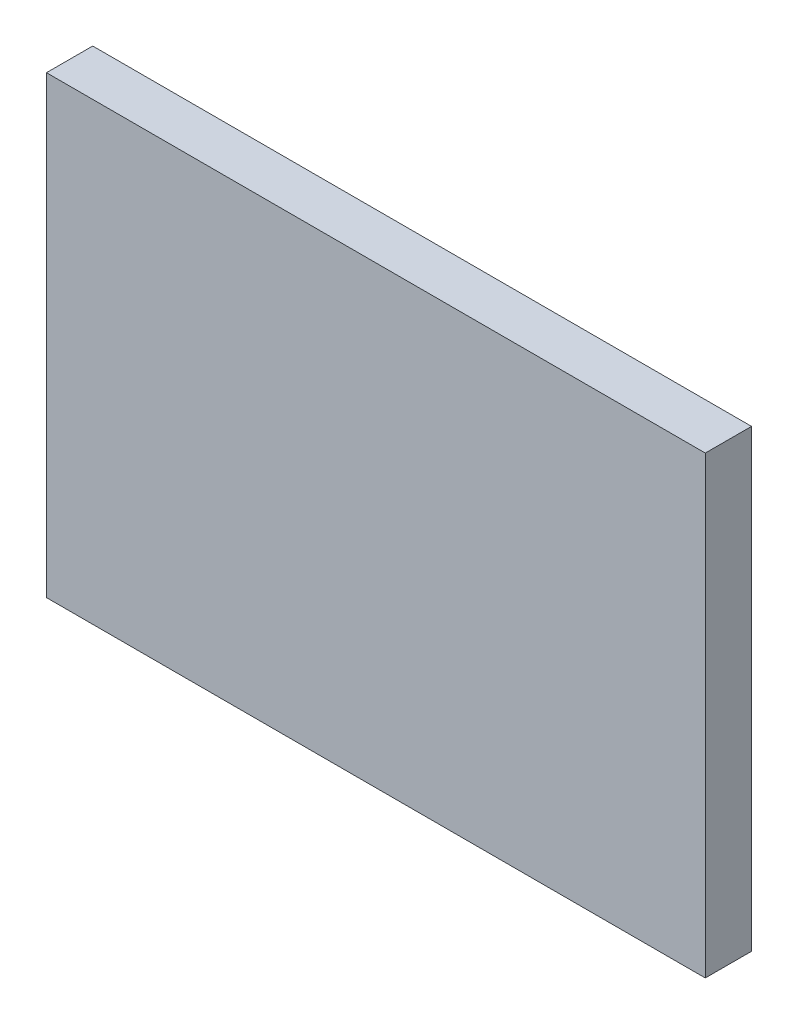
SolidWorks part; units mm, degrees
ref_plane "Plan de face" through (0, 0, 0) normal (0, 0, 1) x (1, 0, 0)
ref_plane "Plan de dessus" through (0, 0, 0) normal (0, 1, 0) x (1, 0, 0)
ref_plane "Plan de droite" through (0, 0, 0) normal (1, 0, 0) x (0, 0, -1)
sketch "Esquisse1" plane through (0, 0, 0) normal (0, 0, 1) x (1, 0, 0)
  line L1 (-70, 40) -> (15.5, 40)
  line L2 (-70, 40) -> (-70, -19)
  line L3 (-70, -19) -> (15.5, -19)
  line L4 (15.5, 40) -> (15.5, -19)
  dimension "D1" = 85.5
  dimension "D2" = 59
extrude "Extrusion1" add sketch "Esquisse1" along normal blind 6
